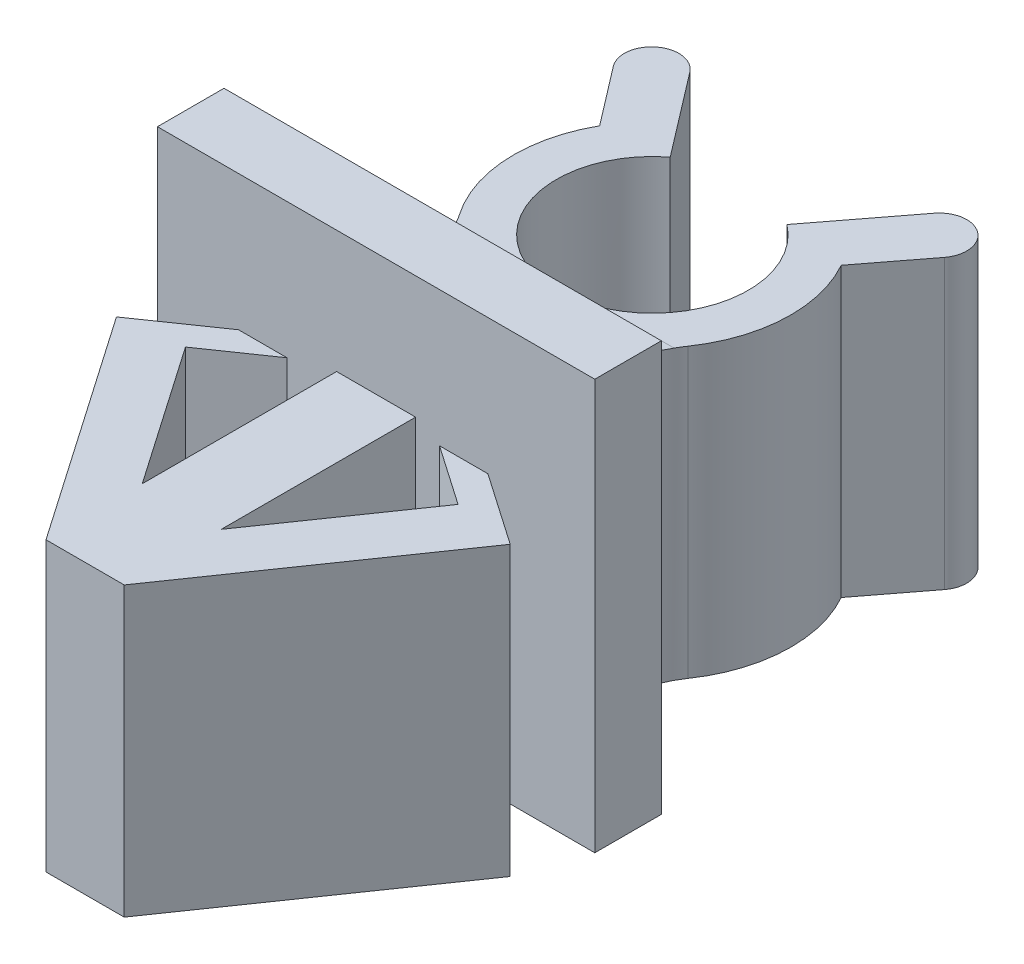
SolidWorks part; units mm, degrees
ref_plane "Front Plane" through (0, 0, 0) normal (0, 0, 1) x (1, 0, 0)
ref_plane "Top Plane" through (0, 0, 0) normal (0, 1, 0) x (1, 0, 0)
ref_plane "Right Plane" through (0, 0, 0) normal (1, 0, 0) x (0, 0, -1)
sketch "Sketch1" plane through (0, 0, 0) normal (0, 1, 0) x (1, 0, 0)
  line L0 (0, 0) -> (0, 3.6581) construction
  line L1 (-1.9063, 2.4909) -> (-3.994, 5.219)
  line L2 (-5.4091, 4.1361) -> (-3.9459, 2.2241)
  line L3 (5.4091, 4.1361) -> (3.9459, 2.2241)
  line L4 (1.9063, 2.4909) -> (3.994, 5.219)
  line L5 (0, 0) -> (0, -12.0428) construction
  line L6 (-7.1437, -5.8491) -> (-4.1107, -5.8491)
  line L7 (-7.1437, -5.8491) -> (-7.1437, -9.0241)
  line L8 (-7.1437, -9.0241) -> (-1.2903, -9.0241)
  line L9 (7.1438, -5.8491) -> (7.1438, -9.0241)
  line L10 (2.6045, -3.7059) -> (4.1107, -5.8491)
  line L11 (-2.6045, -3.7059) -> (-4.1107, -5.8491)
  line L12 (4.1107, -5.8491) -> (7.1438, -5.8491)
  line L13 (-1.2903, -9.0241) -> (-1.2903, -15.3741)
  line L14 (-1.2903, -15.3741) -> (-4.4525, -10.8001)
  line L15 (-4.4525, -10.8001) -> (-2.4922, -9.4449)
  line L16 (-2.4922, -9.4449) -> (-4.0733, -9.4449)
  line L17 (-4.0733, -9.4449) -> (-6.432, -11.0756)
  line L18 (-6.432, -11.0756) -> (-1.2775, -18.5314)
  line L19 (-1.2775, -18.5314) -> (1.2775, -18.5314)
  line L20 (6.432, -11.0756) -> (1.2775, -18.5314)
  line L21 (4.4525, -10.8001) -> (2.4922, -9.4449)
  line L22 (2.4922, -9.4449) -> (4.0733, -9.4449)
  line L23 (4.0733, -9.4449) -> (6.432, -11.0756)
  line L24 (1.2903, -15.3741) -> (4.4525, -10.8001)
  line L25 (1.2903, -9.0241) -> (1.2903, -15.3741)
  line L26 (1.2903, -9.0241) -> (7.1438, -9.0241)
  arc A0 (-1.9063, 2.4909) -> (1.9063, 2.4909) centre (0, 0) ccw
  arc A1 (-5.4091, 4.1361) -> (-3.994, 5.219) centre (-4.7016, 4.6775) cw
  arc A2 (5.4091, 4.1361) -> (3.994, 5.219) centre (4.7016, 4.6775) ccw
  arc A3 (-3.9459, 2.2241) -> (-2.6045, -3.7059) centre (0, 0) ccw
  arc A4 (2.6045, -3.7059) -> (3.9459, 2.2241) centre (0, 0) ccw
  point P31 (0, -18.5314)
  dimension "D1" = 3.175
  dimension "D2" = 14.2875
  dimension "D3" = 7.1437
  dimension "D4" = 6.35
extrude "Boss-Extrude1" add sketch "Sketch1" along normal blind 9.4 contours L8 L13 L14 L15 L16 L17 L18 L19 L20 L23 L22 L21 L24 L25 L26 L9 L12 L10 A4 L3 A2 L4 A0 L1 A1 L2 A3 L11 L6 L7
sketch "Sketch2" plane through (0, 9.4, 0) normal (0, 1, 0) x (1, 0, 0)
  line L1 (-7.1437, -5.8491) -> (7.1438, -5.8491)
  line L2 (-7.1437, -5.8491) -> (-7.1437, -9.0241)
  line L3 (-7.1437, -9.0241) -> (7.1438, -9.0241)
  line L4 (7.1438, -5.8491) -> (7.1438, -9.0241)
extrude "Boss-Extrude2" add sketch "Sketch2" along normal blind 4
fillet "Fillet1" radius 3 3 edges
chamfer "Chamfer1" distance 1 angle 45 3 edges at (7.1438, 6.7, 5.8491) (0, 13.4, 5.8491) (-7.1437, 6.7, 5.8491)
fillet "Fillet2" radius 3 2 edges at (2.6045, 4.7625, 3.7059) (-2.6045, 4.7625, 3.7059)
